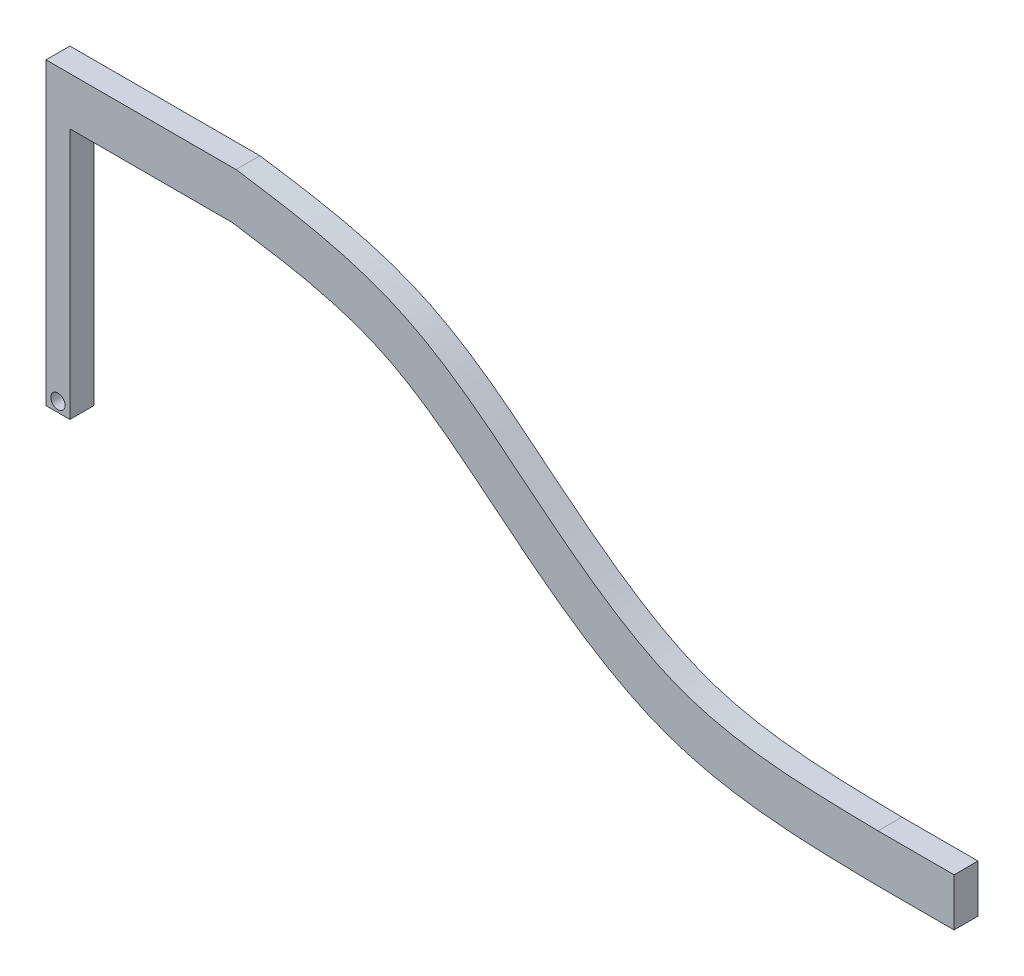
SolidWorks part; units mm, degrees
ref_plane "Front Plane" through (0, 0, 0) normal (0, 0, 1) x (1, 0, 0)
ref_plane "Top Plane" through (0, 0, 0) normal (0, 1, 0) x (1, 0, 0)
ref_plane "Right Plane" through (0, 0, 0) normal (1, 0, 0) x (0, 0, -1)
sketch "Sketch2" plane through (0, 0, 0) normal (0, 0, 1) x (1, 0, 0)
  line L0 (0, 0) -> (0, 13.3821)
  line L1 (0, 13.3821) -> (8.6425, 13.3821)
  line L2 (42.9413, 0) -> (47.0053, 0)
  spline S0 degree 3 poles (8.6425, 13.3821) (11.3837, 12.9651) (16.6168, 12.169) (23.4661, 6.449) (31.479, 0.1898) (39.0643, 0.0642) (42.9413, 0) knots 0 0 0 0 0.216097 0.412538 0.699741 1 1 1 1
extrude "Extrude-Thin1" add sketch "Sketch2" along normal blind 1.27 thin
sketch "Sketch3" plane through (0, 0, 1.27) normal (0, 0, 1) x (1, 0, 0)
  line L0 (-1.27, 0) -> (-1.27, 15.9221)
  line L1 (0, 0) -> (-2.54, 0) construction
  line L2 (-2.54, 15.9221) -> (8.8346, 15.9221) construction
extrude "Extrude1" cut sketch "Sketch3" against normal through all and the other way through all
sketch "Sketch4" plane through (0, 0, 1.27) normal (0, 0, 1) x (1, 0, 0)
  circle A0 centre (-0.635, 0.517) radius 0.381
extrude "Extrude2" cut sketch "Sketch4" against normal through all
